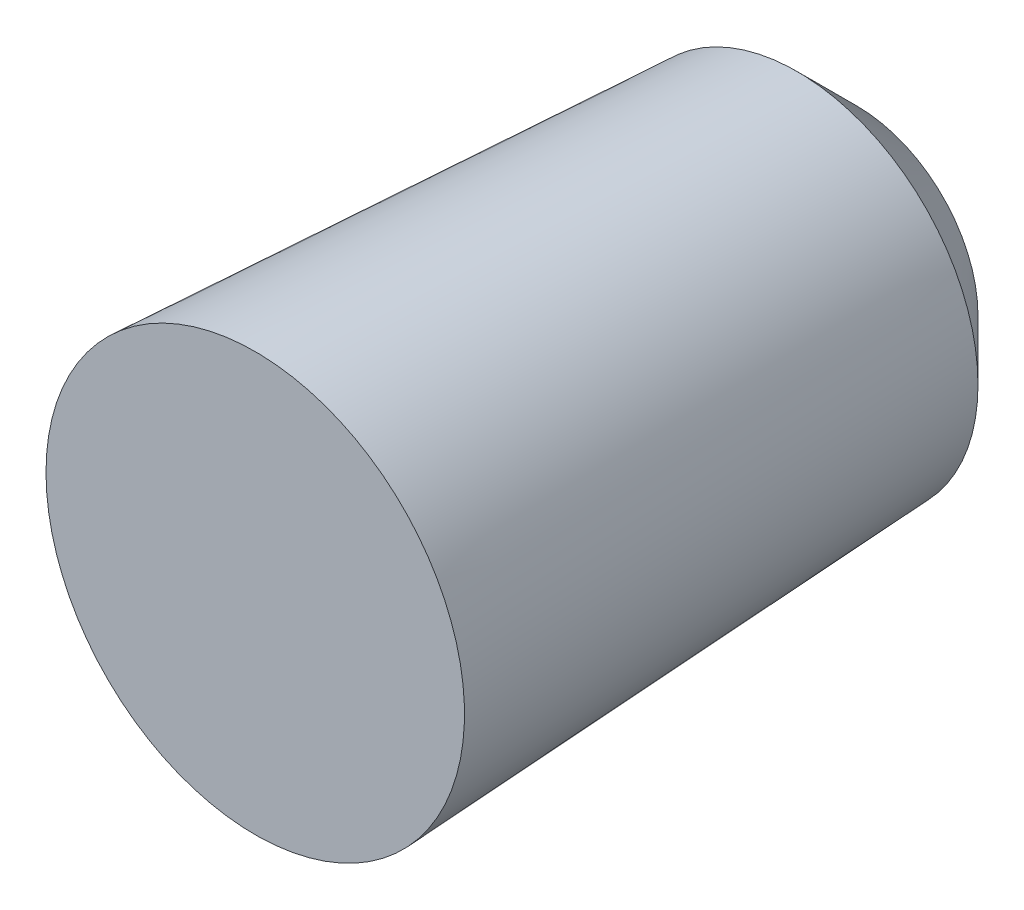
SolidWorks part; units mm, degrees
ref_plane "Plan de face" through (0, 0, 0) normal (0, 0, 1) x (1, 0, 0)
ref_plane "Plan de dessus" through (0, 0, 0) normal (0, 1, 0) x (1, 0, 0)
ref_plane "Plan de droite" through (0, 0, 0) normal (1, 0, 0) x (0, 0, -1)
sketch "Esquisse1" plane through (0, 0, 0) normal (0, 0, 1) x (1, 0, 0)
  circle A0 centre (20.6363, 75.3928) radius 25
  arc A1 (25.7108, 69.2483) -> (-25.7108, 69.2483) centre (0, 53.1824) ccw construction
  dimension "D1" = 50
extrude "Boss.-Extru.1" add sketch "Esquisse1" along normal up to surface (84.6814 mm away) draft 3
chamfer "Chanfrein1" distance 8 angle 45 1 edges at (45.6363, 75.3928, 0)
